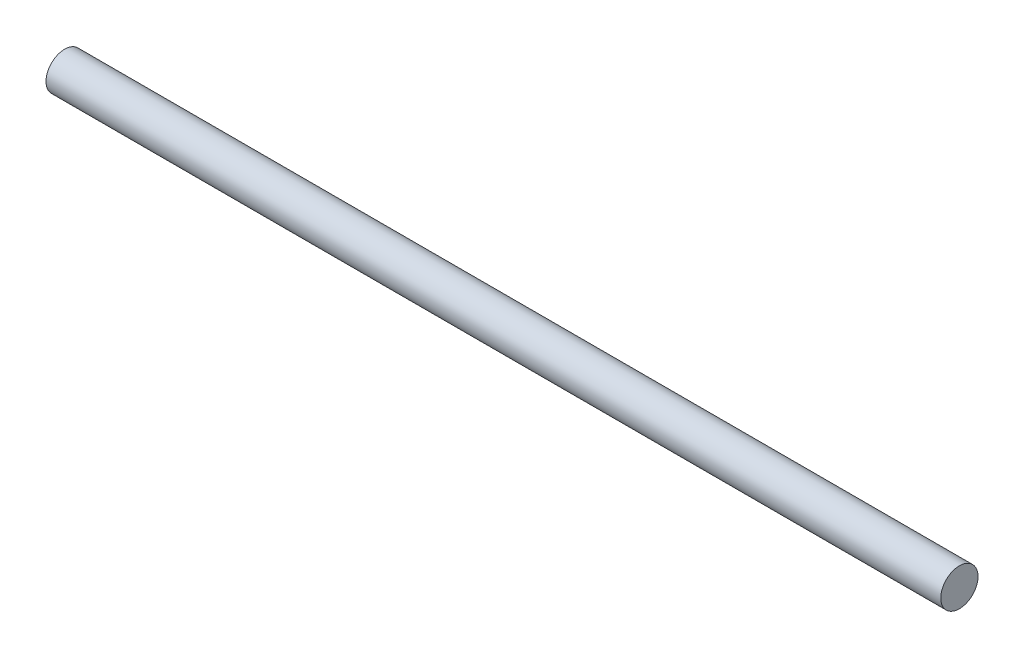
SolidWorks part; units mm, degrees
ref_plane "Front Plane" through (0, 0, 0) normal (0, 0, 1) x (1, 0, 0)
ref_plane "Top Plane" through (0, 0, 0) normal (0, 1, 0) x (1, 0, 0)
ref_plane "Right Plane" through (0, 0, 0) normal (1, 0, 0) x (0, 0, -1)
sketch "Sketch1" plane through (0, 0, 0) normal (1, 0, 0) x (0, 0, -1)
  circle A0 centre (0, 0) radius 6.35
  dimension "D1" = 12.7
extrude "Boss-Extrude1" add sketch "Sketch1" along normal blind 304.8
ref_plane "Plane1" through (152.4, 0, 0) normal (1, 0, 0) x (0, 0, -1)
